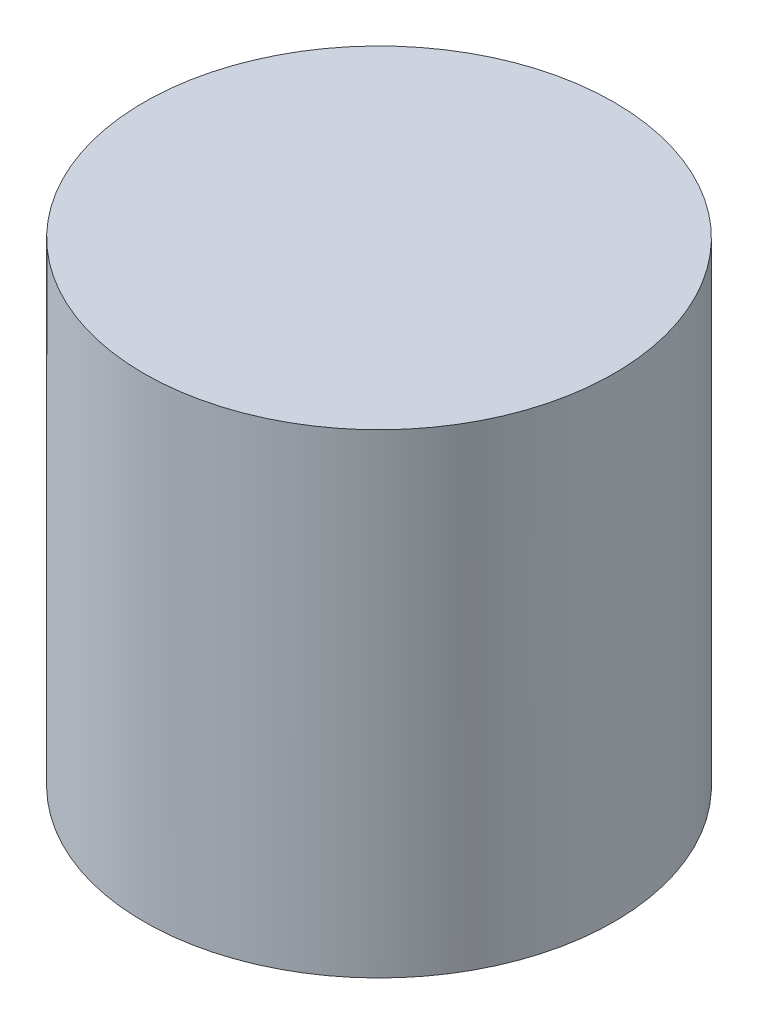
SolidWorks part; units mm, degrees
ref_plane "Ebene vorne" through (0, 0, 0) normal (0, 0, 1) x (1, 0, 0)
ref_plane "Ebene oben" through (0, 0, 0) normal (0, 1, 0) x (1, 0, 0)
ref_plane "Ebene rechts" through (0, 0, 0) normal (1, 0, 0) x (0, 0, -1)
sketch "Skizze1" plane through (0, 0, 0) normal (0, 0, 1) x (1, 0, 0)
  circle A0 centre (0, 0) radius 100
  dimension "D1" = 200
extrude "Aufsatz-Linear austragen1" add sketch "Skizze1" along normal blind 2
sketch "Skizze2" plane through (0, 0, 2) normal (0, 0, 1) x (1, 0, 0)
  circle A0 centre (0, 0) radius 25
  dimension "D1" = 50
extrude "Aufsatz-Linear austragen2" add sketch "Skizze2" along normal blind 50
ref_plane "Ebene1" through (0, 105, 0) normal (0, 1, 0) x (1, 0, 0)
sketch "Skizze4" plane through (0, 105, 0) normal (0, 1, 0) x (1, 0, 0)
  circle A0 centre (0, 105) radius 100
  dimension "D1" = 200
  dimension "D2" = 105
other "Begrenzung1"
sketch "Skizze5" plane through (0, 105, 0) normal (0, 1, 0) x (1, 0, 0)
  circle A1 centre (0, 105) radius 100 construction
  circle A2 centre (0, 105) radius 98
  circle A3 centre (0, 105) radius 98
  circle A4 centre (0, 105) radius 100
  dimension "D1" = 2
extrude "Aufsatz-Linear austragen3" add sketch "Skizze5" along normal blind 300
mirror "Spiegeln2" about plane through (0, 405, -105) normal (0, 1, 0)
sketch "Skizze6" plane through (0, 0, 52) normal (0, 0, 1) x (1, 0, 0)
  circle A2 centre (0, 810) radius 25
  circle A3 centre (0, 810) radius 25
  dimension "D1" = 0
extrude "Schnitt-Linear austragen1" cut sketch "Skizze6" against normal blind 100
sketch "Skizze7" plane through (0, 105, 0) normal (0, 1, 0) x (1, 0, 0)
  line L1 (-191.6655, 243.8114) -> (180.9218, 243.8114)
  line L2 (-191.6655, 243.8114) -> (-191.6655, -81.9332)
  line L3 (-191.6655, -81.9332) -> (180.9218, -81.9332)
  line L4 (180.9218, 243.8114) -> (180.9218, -81.9332)
  line L5 (-191.6655, 243.8114) -> (180.9218, -81.9332) construction
  line L6 (-191.6655, -81.9332) -> (180.9218, 243.8114) construction
  point P4 (-5.3718, 80.9391)
extrude "Schnitt-Linear austragen3" cut sketch "Skizze7" against normal blind 250
sketch "Skizze8" plane through (0, 105, 0) normal (0, -1, 0) x (1, 0, 0)
  circle A1 centre (0, -105) radius 100
  circle A2 centre (0, -105) radius 100
  dimension "D1" = 0
extrude "Aufsatz-Linear austragen4" add sketch "Skizze8" along normal blind 52
sketch "Skizze9" plane through (0, 53, 0) normal (0, -1, 0) x (1, 0, 0)
  circle A0 centre (0, -105) radius 25
  dimension "D1" = 50
extrude "Schnitt-Linear austragen4" cut sketch "Skizze9" against normal blind 50
ref_plane "Ebene2" through (0, 253, 0) normal (0, -1, 0) x (-1, 0, 0)
sketch "Skizze10" plane through (0, 253, 0) normal (0, -1, 0) x (-1, 0, 0)
  line L1 (-123.4094, 239.4155) -> (132.3271, 239.4155)
  line L2 (-123.4094, 239.4155) -> (-123.4094, -31.5674)
  line L3 (-123.4094, -31.5674) -> (132.3271, -31.5674)
  line L4 (132.3271, 239.4155) -> (132.3271, -31.5674)
  line L5 (-123.4094, 239.4155) -> (132.3271, -31.5674) construction
  line L6 (-123.4094, -31.5674) -> (132.3271, 239.4155) construction
  point P4 (4.4588, 103.9241)
extrude "Schnitt-Linear austragen5" cut sketch "Skizze10" against normal through all
sketch "Skizze11" plane through (0, 253, 0) normal (0, 1, 0) x (1, 0, 0)
  circle A1 centre (0, 105) radius 100
  circle A2 centre (0, 105) radius 100
  dimension "D1" = 0
extrude "Aufsatz-Linear austragen5" add sketch "Skizze11" along normal blind 2
